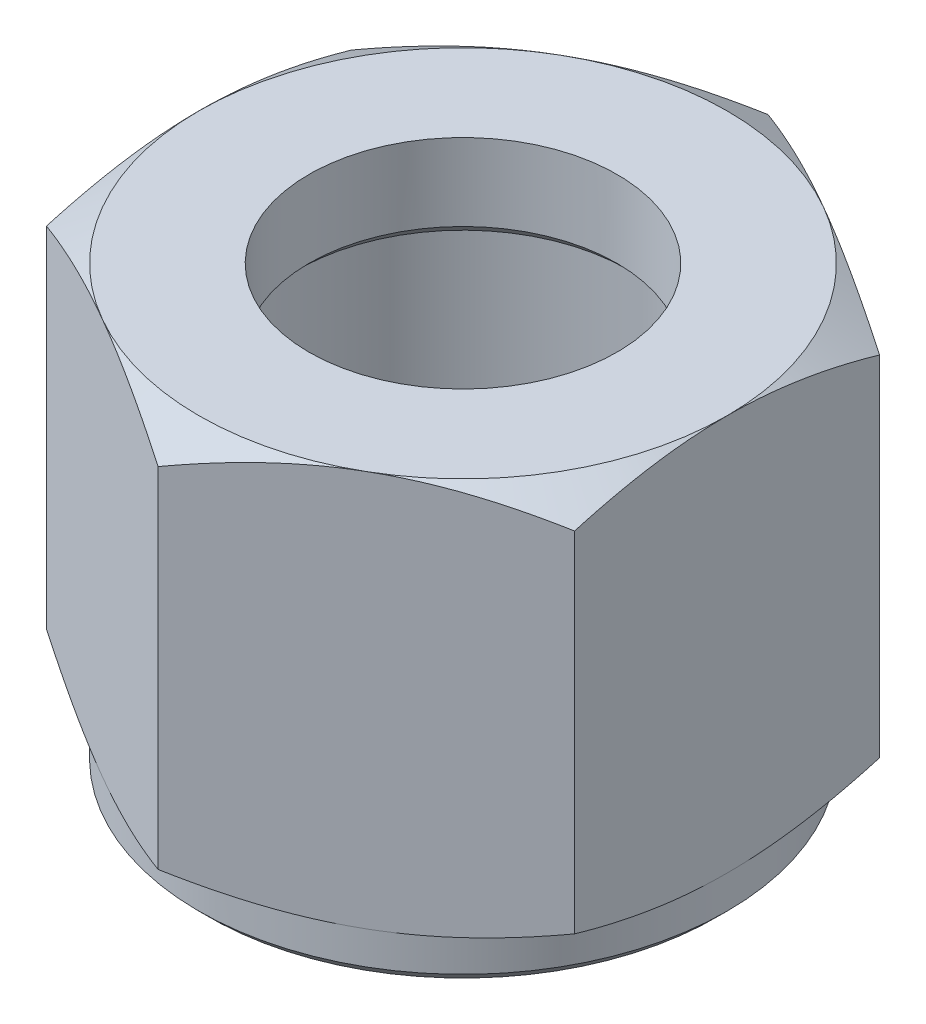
SolidWorks part; units mm, degrees
ref_plane "Přední rovina" through (0, 0, 0) normal (0, 0, 1) x (1, 0, 0)
ref_plane "Horní rovina" through (0, 0, 0) normal (0, 1, 0) x (1, 0, 0)
ref_plane "Pravá rovina" through (0, 0, 0) normal (1, 0, 0) x (0, 0, -1)
sketch "Skica1" plane through (0, 0, 0) normal (0, 1, 0) x (1, 0, 0)
  line L1 (0, 13.8564) -> (-12, 6.9282)
  line L2 (-12, 6.9282) -> (-12, -6.9282)
  line L3 (-12, -6.9282) -> (0, -13.8564)
  line L4 (0, -13.8564) -> (12, -6.9282)
  line L5 (12, -6.9282) -> (12, 6.9282)
  line L6 (12, 6.9282) -> (0, 13.8564)
  circle A0 centre (0, 0) radius 12 construction
extrude "Přidat vysunutím1" add sketch "Skica1" along normal blind 18
sketch "Skica2" plane through (0, 18, 0) normal (0, 1, 0) x (-1, 0, 0)
  circle A0 centre (0, 0) radius 12
extrude "Odebrat vysunutím1" cut sketch "Skica2" against normal blind 18 draft 60 flip side to cut
sketch "Skica3" plane through (0, 0, 0) normal (0, -1, 0) x (1, 0, 0)
  circle A0 centre (0, 0) radius 12
extrude "Odebrat vysunutím2" cut sketch "Skica3" against normal blind 18 draft 60 flip side to cut
sketch "Skica4" plane through (0, 0, 0) normal (0, -1, 0) x (1, 0, 0)
  circle A0 centre (0, 0) radius 12
extrude "Přidat vysunutím2" add sketch "Skica4" along normal blind 2
chamfer "Zkosení1" distance 0.5 angle 45 1 edges at (0, -2, -12)
sketch "Skica5" plane through (0, -2, 0) normal (0, -1, 0) x (1, 0, 0)
  circle A0 centre (0, 0) radius 9
extrude "Odebrat vysunutím3" cut sketch "Skica5" against normal blind 16
chamfer "Zkosení2" distance 0.35 angle 45 1 edges at (0, -2, -9)
sketch "Skica6" plane through (0, 18, 0) normal (0, 1, 0) x (1, 0, 0)
  circle A0 centre (0, 0) radius 7
extrude "Odebrat vysunutím4" cut sketch "Skica6" against normal up to surface (4 mm away)
chamfer "Zkosení3" distance 0.5 angle 45 1 edges at (0, 14, -7)
